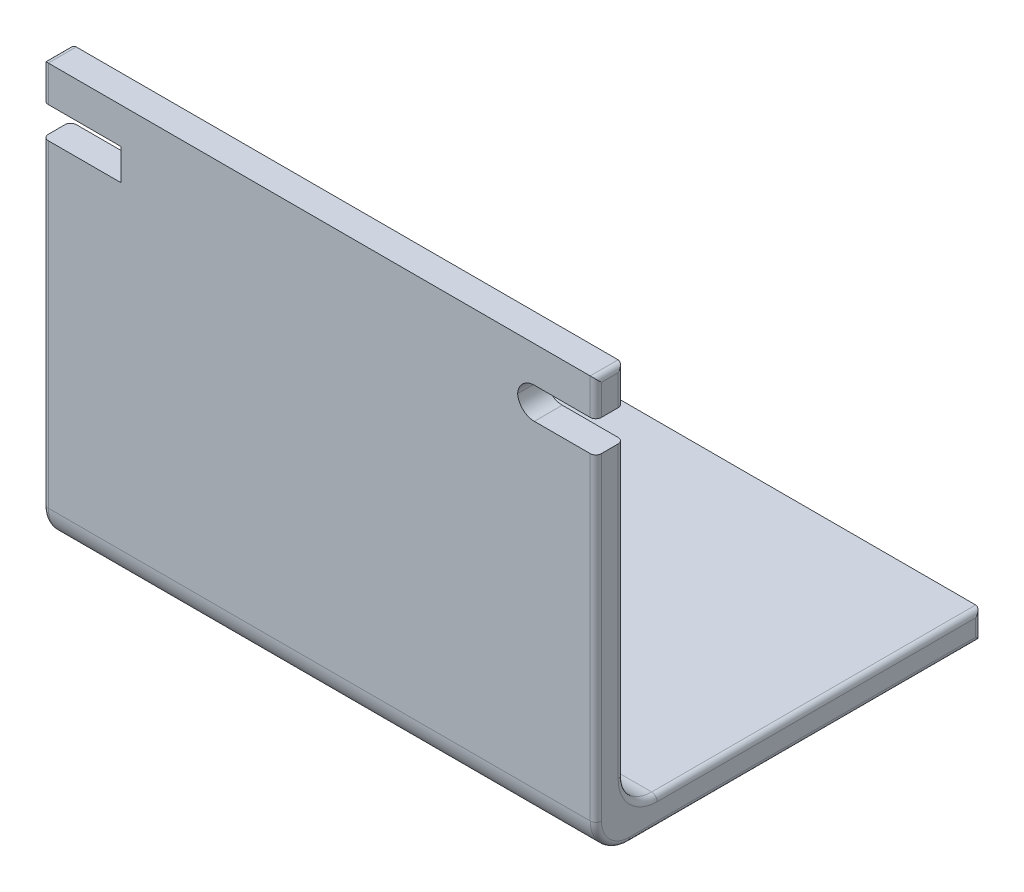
SolidWorks part; units mm, degrees
ref_plane "Front Plane" through (0, 0, 0) normal (0, 0, 1) x (1, 0, 0)
ref_plane "Top Plane" through (0, 0, 0) normal (0, 1, 0) x (1, 0, 0)
ref_plane "Right Plane" through (0, 0, 0) normal (1, 0, 0) x (0, 0, -1)
sketch "Sketch1" plane through (0, 0, 0) normal (1, 0, 0) x (0, 0, -1)
  line L0 (0, 0) -> (0, -37.5)
  line L1 (0, -37.5) -> (34.5, -37.5)
  line L2 (34.5, -37.5) -> (34.5, -35)
  line L3 (34.5, -35) -> (2.5, -35)
  line L4 (2.5, -35) -> (2.5, 0)
  line L5 (2.5, 0) -> (0, 0)
  dimension "D1" = 35
  dimension "D2" = 2.5
  dimension "D3" = 2.5
  dimension "D4" = 32
extrude "Boss-Extrude1" add sketch "Sketch1" along normal blind 49.5
fillet "Fillet1" radius 3 2 edges at (24.75, -37.5, 0) (24.75, -35, -2.5)
fillet "3Dprint Fillet2" radius 0.5 16 edges at (0, -36.25, -34.5) (0, -35, -20) (0, -34.1213, -3.3787) (0, -16, -2.5) (0, 0, -1.25) (0, -17.25, 0) (0, -36.6213, -0.8787) (0, -37.5, -18.75) (49.5, 0, -1.25) (49.5, -16, -2.5) (49.5, -34.1213, -3.3787) (49.5, -35, -20) (49.5, -36.25, -34.5) (49.5, -37.5, -18.75) (49.5, -36.6213, -0.8787) (49.5, -17.25, 0)
sketch "Sketch2" plane through (49.5, 0, 0) normal (1, 0, 0) x (0, 0, -1)
  line L0 (0, -34.5) -> (0, 0) construction
  line L1 (0, -3.22) -> (2.5, -3.22)
  line L2 (0, -3.22) -> (0, -6.02)
  line L3 (0, -6.02) -> (2.5, -6.02)
  line L4 (2.5, -3.22) -> (2.5, -6.02)
  line L5 (2.5, 0) -> (2.5, -32) construction
  line L6 (0, 0) -> (2.5, 0) construction
  dimension "D1" = 6.02
  dimension "D2" = 2.8
extrude "slot" cut sketch "Sketch2" against normal blind 7
ref_plane "Plane1" through (24.75, 0, 0) normal (-1, 0, 0) x (0, 0, 1)
mirror "Mirror1" about plane through (24.75, 0, 0) normal (-1, 0, 0) of "slot"
fillet "Fillet2" radius 1.5 2 edges at (42.5, -6.02, -1.25) (42.5, -3.22, -1.25)
